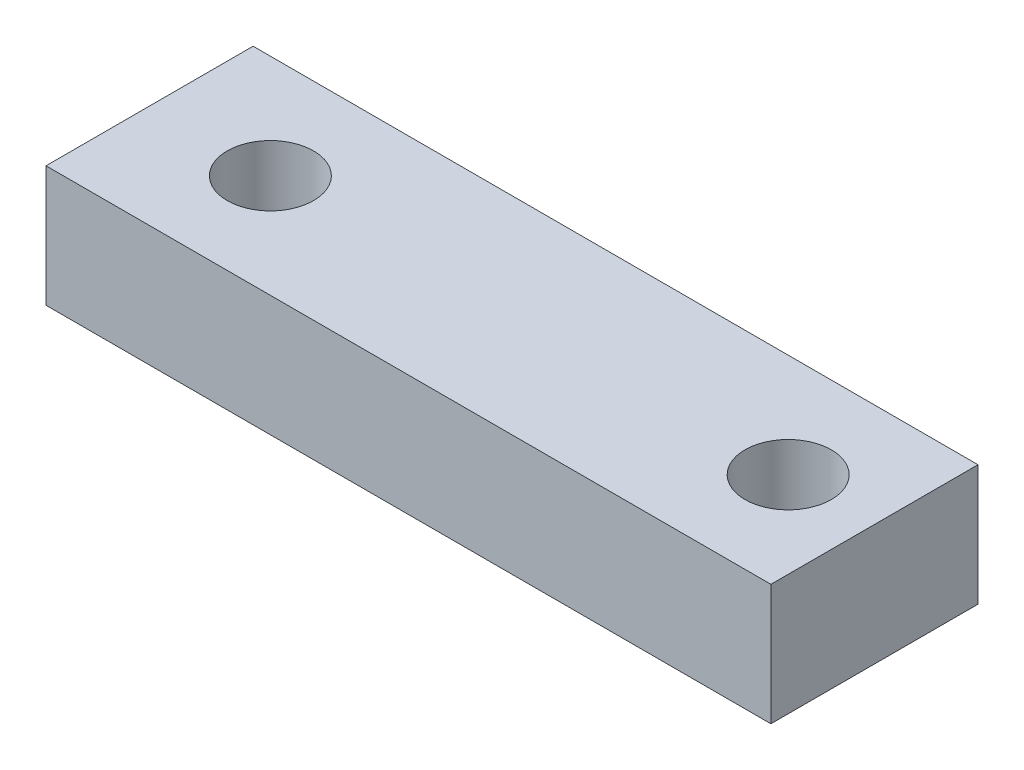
SolidWorks part; units mm, degrees
ref_plane "Plan de face" through (0, 0, 0) normal (0, 0, 1) x (1, 0, 0)
ref_plane "Plan de dessus" through (0, 0, 0) normal (0, 1, 0) x (1, 0, 0)
ref_plane "Plan de droite" through (0, 0, 0) normal (1, 0, 0) x (0, 0, -1)
sketch "Esquisse1" plane through (0, 0, 0) normal (0, 1, 0) x (1, 0, 0)
  line L0 (42, 6) -> (0, 6) construction
  line L1 (0, 0) -> (42, 0)
  line L2 (0, 0) -> (0, 12)
  line L3 (0, 12) -> (42, 12)
  line L4 (42, 0) -> (42, 12)
  circle A0 centre (37, 6) radius 2.5
  circle A1 centre (7, 6) radius 2.5
  dimension "D3" = 30
  dimension "D4" = 5
  dimension "D1" = 42
  dimension "D2" = 12
extrude "Extrusion1" add sketch "Esquisse1" along normal blind 7
